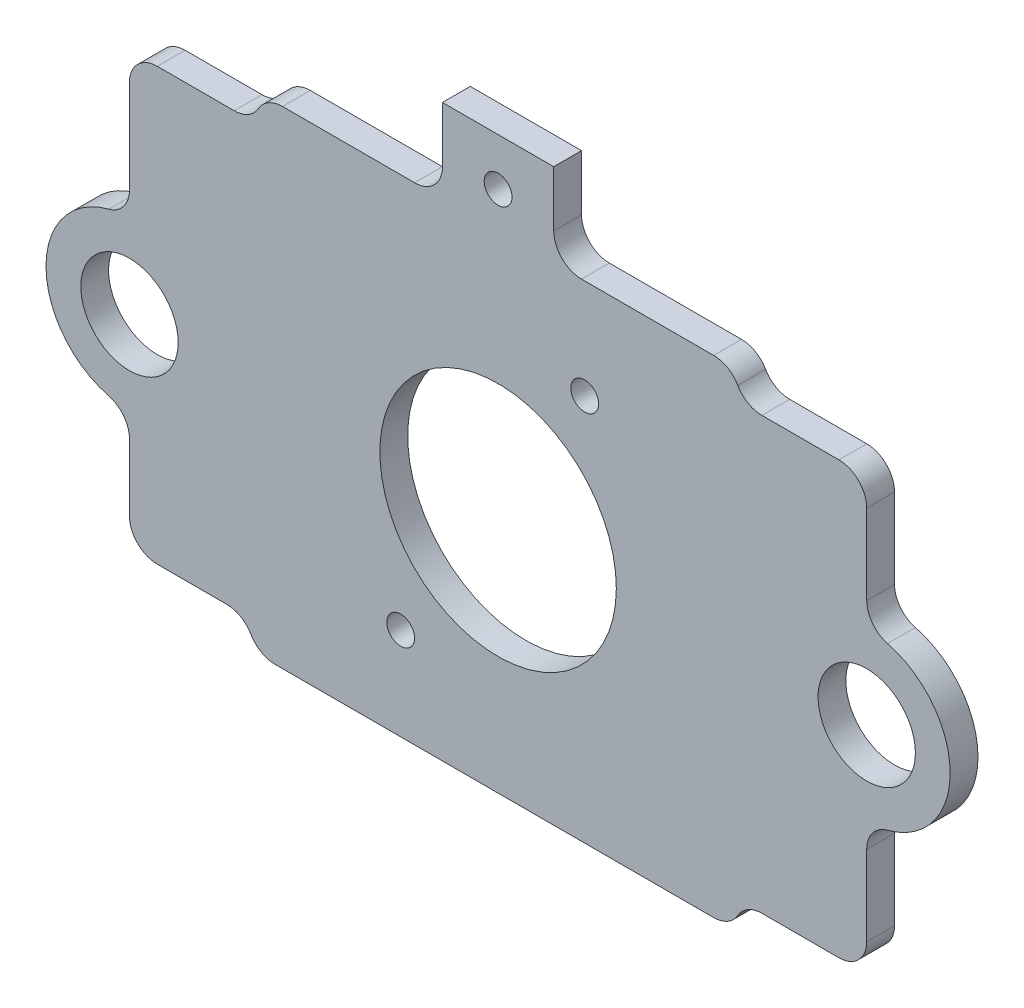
SolidWorks part; units mm, degrees
ref_plane "Plane1" through (0, 0, 0) normal (0, 0, 1) x (1, 0, 0)
ref_plane "Plane2" through (0, 0, 0) normal (0, 1, 0) x (1, 0, 0)
ref_plane "Plane3" through (0, 0, 0) normal (1, 0, 0) x (0, 0, -1)
sketch "Esquisse1" plane through (0, 0, 0) normal (0, 0, 1) x (1, 0, 0)
  line L0 (-17.5, -17) -> (17.5, -17)
  line L1 (-26.5, -6.45) -> (-26.5, -15)
  line L2 (-17.5, 18) -> (-4, 18)
  line L3 (26.5, -5.5) -> (26.5, -15)
  line L4 (-4, 18) -> (-4, 24)
  line L5 (-26.5, 8.6) -> (-26.5, -9.5) construction
  line L6 (26.5, 8.6) -> (26.5, -7.6) construction
  line L7 (0, 0) -> (-30.4, 0) construction
  line L8 (0, 0) -> (30.3, 0) construction
  line L9 (-26.5, 16) -> (-26.5, 5.55)
  line L10 (26.5, 16) -> (26.5, 6.5)
  line L11 (-26.5, 16) -> (-17.5, 16)
  line L12 (-26.5, -15) -> (-17.5, -15)
  line L13 (-17.5, 16) -> (-17.5, 18)
  line L14 (-17.5, -15) -> (-17.5, -17)
  line L15 (0, 14.3) -> (0, -9.5) construction
  line L16 (26.5, -15) -> (17.5, -15)
  line L17 (26.5, 16) -> (17.5, 16)
  line L18 (17.5, 16) -> (17.5, 18)
  line L19 (17.5, -15) -> (17.5, -17)
  line L20 (-4, 24) -> (4, 24)
  line L21 (4, 24) -> (4, 18)
  line L22 (0, 14.3) -> (0, 26.9) construction
  line L23 (4, 18) -> (17.5, 18)
  line L24 (7.2, 12.4) -> (-9.9, -15) construction
  circle A0 centre (0, 0) radius 8.5
  circle A1 centre (-26.5, -0.45) radius 3.5
  circle A2 centre (26.5, 0.5) radius 3.5
  arc A3 (-26.5, 5.55) -> (-26.5, -6.45) centre (-26.5, -0.45) ccw
  arc A4 (26.5, -5.5) -> (26.5, 6.5) centre (26.5, 0.5) ccw
  circle A5 centre (0, 20.6) radius 1
  circle A7 centre (6.2259, 10.8392) radius 1
  circle A8 centre (-7.0013, -10.3553) radius 1
  dimension "D1" = 17
  dimension "D8" = 7
  dimension "D9" = 7
  dimension "D10" = 12
  dimension "D12" = 2
  dimension "D14" = 2
  dimension "D15" = 2
  dimension "D2" = 17
  dimension "D3" = 2
  dimension "D4" = 2
  dimension "D5" = 6
  dimension "D6" = 4
  dimension "D7" = 26.5
  dimension "D11" = 8
extrude "Base-Extrusion" add sketch "Esquisse1" along normal blind 2
fillet "Congé1" radius 2
fillet "Congé2" radius 2
fillet "Congé5" radius 2
fillet "Congé6" radius 2
fillet "Congé7" radius 2
fillet "Congé9" radius 2
fillet "Congé10" radius 2
fillet "Congé12" radius 2
fillet "Congé13" radius 2
